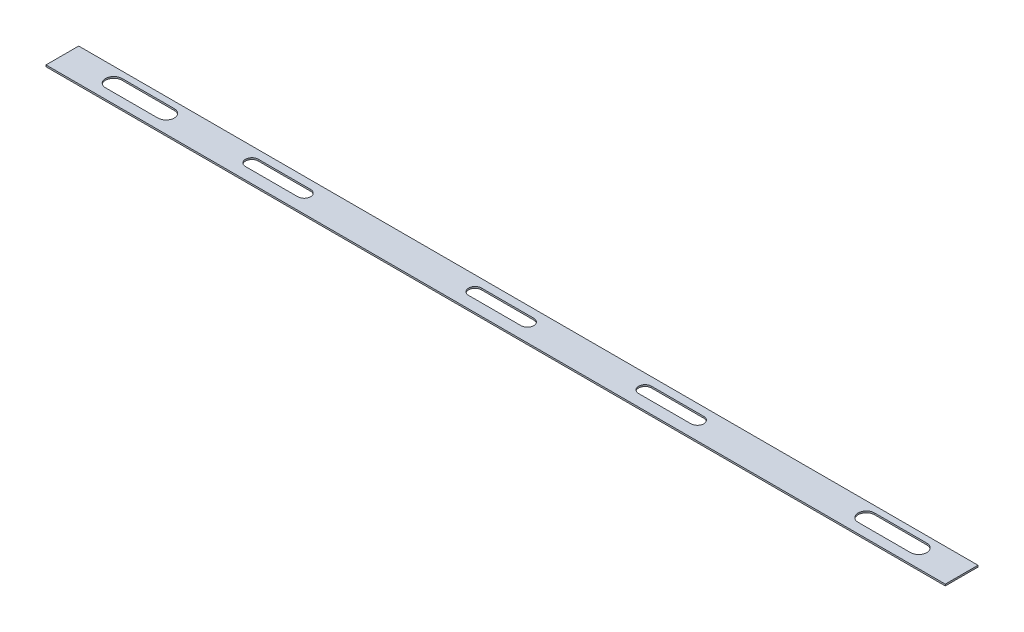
SolidWorks part; units mm, degrees
ref_plane "Front Plane" through (0, 0, 0) normal (0, 0, 1) x (1, 0, 0)
ref_plane "Top Plane" through (0, 0, 0) normal (0, 1, 0) x (1, 0, 0)
ref_plane "Right Plane" through (0, 0, 0) normal (1, 0, 0) x (0, 0, -1)
sketch "Sketch1" plane through (0, 0, 0) normal (0, 1, 0) x (1, 0, 0)
  line L1 (0, 0) -> (349.25, 0)
  line L2 (0, 0) -> (0, 12.7)
  line L3 (0, 12.7) -> (349.25, 12.7)
  line L4 (349.25, 0) -> (349.25, 12.7)
  dimension "D1" = 12.7
  dimension "D2" = 349.25
extrude "Boss-Extrude1" add sketch "Sketch1" along normal blind 0.635
sketch "Sketch4" plane through (0, 0.635, 0) normal (0, 1, 0) x (1, 0, 0)
  line L0 (19.2867, 7.0296) -> (39.6067, 7.0296) construction
  line L1 (19.2867, 10.2046) -> (39.6067, 10.2046)
  line L2 (19.2867, 3.8546) -> (39.6067, 3.8546)
  line L3 (72.9347, 7.0296) -> (93.2547, 7.0296) construction
  line L4 (72.9347, 9.5061) -> (93.2547, 9.5061)
  line L5 (72.9347, 4.5531) -> (93.2547, 4.5531)
  line L6 (159.6023, 7.0296) -> (179.9223, 7.0296) construction
  line L7 (159.6023, 9.5188) -> (179.9223, 9.5188)
  line L8 (159.6023, 4.5404) -> (179.9223, 4.5404)
  line L9 (225.6165, 7.0296) -> (245.9365, 7.0296) construction
  line L10 (225.6165, 9.5188) -> (245.9365, 9.5188)
  line L11 (225.6165, 4.5404) -> (245.9365, 4.5404)
  line L12 (311.5597, 7.0296) -> (331.8797, 7.0296) construction
  line L13 (311.5597, 10.2046) -> (331.8797, 10.2046)
  line L14 (311.5597, 3.8546) -> (331.8797, 3.8546)
  arc A0 (19.2867, 10.2046) -> (19.2867, 3.8546) centre (19.2867, 7.0296) ccw
  arc A1 (39.6067, 3.8546) -> (39.6067, 10.2046) centre (39.6067, 7.0296) ccw
  arc A2 (72.9347, 9.5061) -> (72.9347, 4.5531) centre (72.9347, 7.0296) ccw
  arc A3 (93.2547, 4.5531) -> (93.2547, 9.5061) centre (93.2547, 7.0296) ccw
  arc A4 (159.6023, 9.5188) -> (159.6023, 4.5404) centre (159.6023, 7.0296) ccw
  arc A5 (179.9223, 4.5404) -> (179.9223, 9.5188) centre (179.9223, 7.0296) ccw
  arc A6 (225.6165, 9.5188) -> (225.6165, 4.5404) centre (225.6165, 7.0296) ccw
  arc A7 (245.9365, 4.5404) -> (245.9365, 9.5188) centre (245.9365, 7.0296) ccw
  arc A8 (311.5597, 10.2046) -> (311.5597, 3.8546) centre (311.5597, 7.0296) ccw
  arc A9 (331.8797, 3.8546) -> (331.8797, 10.2046) centre (331.8797, 7.0296) ccw
  point P2 (29.4467, 7.0296)
  point P7 (83.0947, 7.0296)
  point P14 (169.7623, 7.0296)
  point P21 (235.7765, 7.0296)
  point P28 (321.7197, 7.0296)
  dimension "D1" = 6.35
  dimension "D2" = 4.953
  dimension "D3" = 4.9784
  dimension "D4" = 4.9784
  dimension "D5" = 6.35
  dimension "D6" = 20.32
  dimension "D7" = 20.32
  dimension "D8" = 20.32
  dimension "D9" = 20.32
  dimension "D10" = 20.32
extrude "Cut-Extrude2" cut sketch "Sketch4" against normal through all
